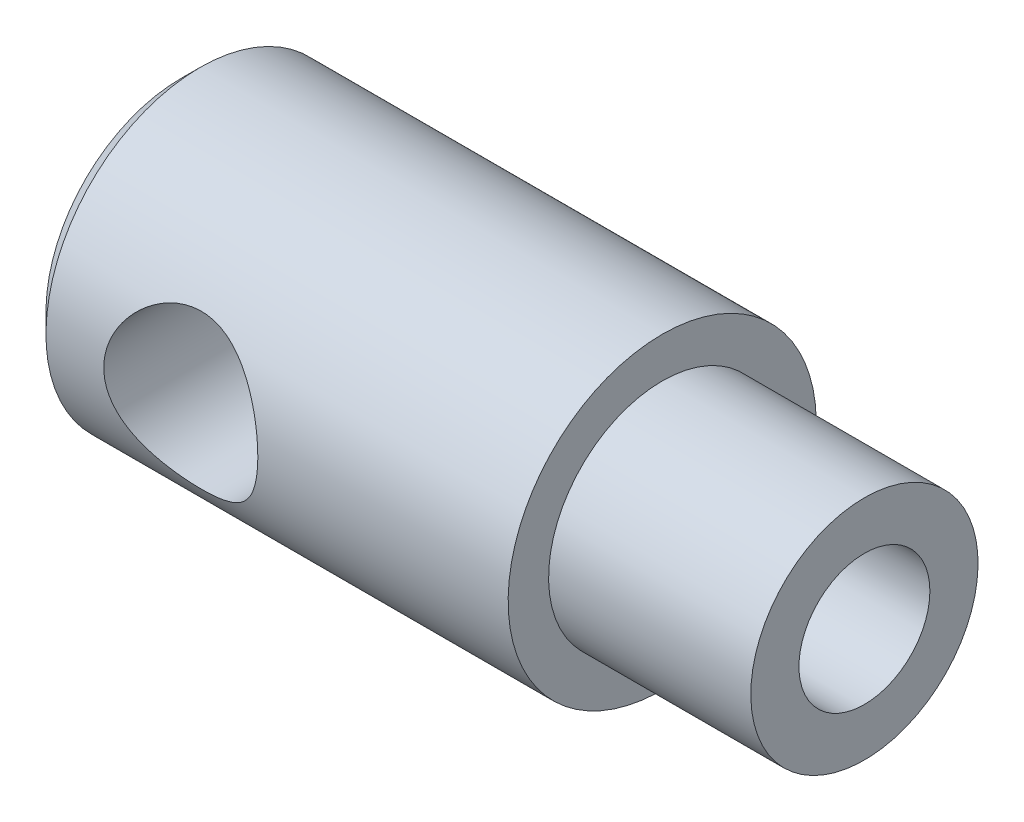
SolidWorks part; units mm, degrees
ref_plane "Front Plane" through (0, 0, 0) normal (0, 0, 1) x (1, 0, 0)
ref_plane "Top Plane" through (0, 0, 0) normal (0, 1, 0) x (1, 0, 0)
ref_plane "Right Plane" through (0, 0, 0) normal (1, 0, 0) x (0, 0, -1)
sketch "Sketch1" plane through (0, 0, 0) normal (0, 0, 1) x (1, 0, 0)
  line L0 (0, 0) -> (0, 7)
  line L1 (0, 7) -> (1, 8)
  line L2 (1, 8) -> (25, 8)
  line L3 (25, 8) -> (25, 5.9)
  line L4 (25, 5.9) -> (35.5, 5.9)
  line L5 (35.5, 5.9) -> (35.5, 0)
  line L6 (35.5, 0) -> (0, 0)
  dimension "D1" = 1
  dimension "D2" = 1
  dimension "D3" = 8
  dimension "D4" = 5.9
  dimension "D5" = 10.5
  dimension "D6" = 25
revolve "Revolve1" add sketch "Sketch1" angle 360 about L6
sketch "Sketch2" plane through (0, 0, 0) normal (0, 0, 1) x (1, 0, 0)
  line L0 (0, 0) -> (35.5, 0) construction
  line L1 (35.5, -5.9) -> (35.5, 5.9) construction
  line L2 (0, 7) -> (0, -7) construction
  circle A0 centre (8, 0) radius 4
  dimension "D1" = 8
  dimension "D2" = 8
extrude "Extrude1" cut sketch "Sketch2" against normal mid plane 20
sketch "Sketch3" plane through (35.5, 0, 0) normal (1, 0, 0) x (0, 0, -1)
  point P0 (0, 0)
hole_wizard "M8 Tapped Hole1" positions "3DSketch1" profile "Sketch4" tap size "M8" standard "ISO"
sketch3d "3DSketch1"
  point P0 (35.5, 0, 0)
sketch "Sketch4" plane through (35.5, 0, 0) normal (0, 1, 0) x (0, 0, -1)
  line L0 (0, 0) -> (0, 29.5429)
  line L1 (0, 29.5429) -> (3.4, 27.5)
  line L2 (3.4, 27.5) -> (3.4, 0)
  line L5 (3.4, 0) -> (0, 0)
  line L10 (0, 29.5429) -> (-3.4, 27.5) construction
  line L11 (0, -6.35) -> (0, 107.95) construction
  dimension "Tap Drill Dia." = 6.8
  dimension "Tap Drill Depth" = 27.5
  dimension "Drill Angle" = 118
